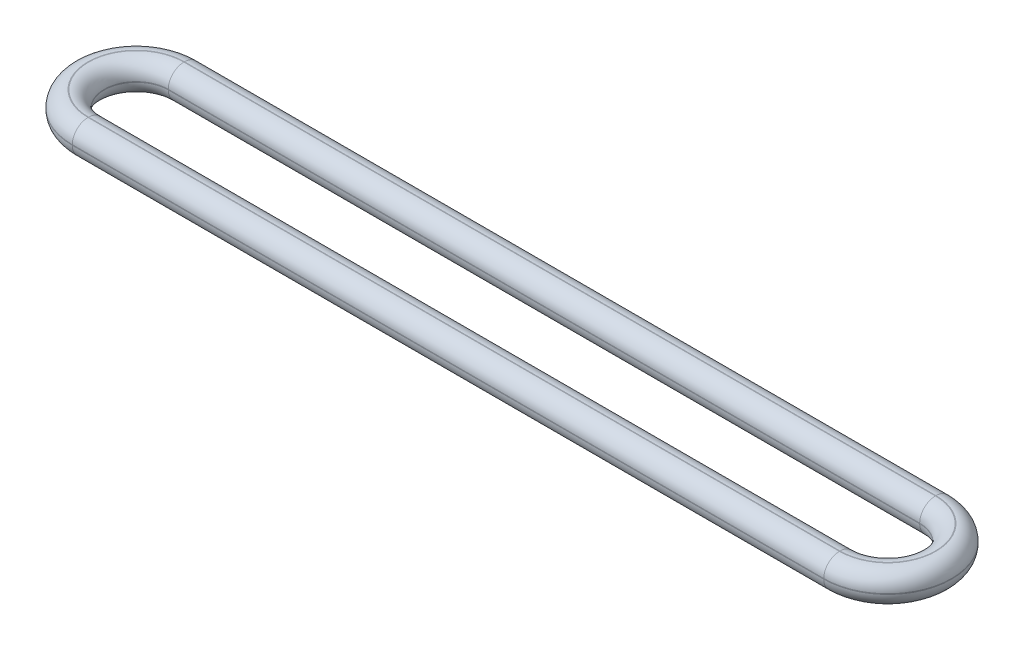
SolidWorks part; units mm, degrees
ref_plane "Front Plane" through (0, 0, 0) normal (0, 0, 1) x (1, 0, 0)
ref_plane "Top Plane" through (0, 0, 0) normal (0, 1, 0) x (1, 0, 0)
ref_plane "Right Plane" through (0, 0, 0) normal (1, 0, 0) x (0, 0, -1)
sketch "Sketch1" plane through (0, 0, 0) normal (0, 1, 0) x (1, 0, 0)
  line L0 (0, 1) -> (23.5, 1)
  line L1 (0, -0.55) -> (0, 0.55) construction
  line L2 (23.5, -1) -> (0, -1)
  line L3 (-0.55, 0) -> (0.55, 0) construction
  line L4 (0, 2) -> (23.5, 2)
  line L5 (23.5, -2) -> (0, -2)
  arc A0 (23.5, 1) -> (23.5, -1) centre (23.5, 0) cw
  arc A1 (0, 1) -> (0, -1) centre (0, 0) ccw
  arc A2 (23.5, 2) -> (23.5, -2) centre (23.5, 0) cw
  arc A3 (0, 2) -> (0, -2) centre (0, 0) ccw
  dimension "D1" = 2
  dimension "D2" = 23.5
  dimension "D3" = 1
extrude "Boss-Extrude1" add sketch "Sketch1" along normal blind 1
fillet "Fillet1" radius 0.49 16 edges at (-1, 0, 0) (11.75, 0, -1) (24.5, 0, 0) (11.75, 0, 1) (24.5, 1, 0) (11.75, 1, -1) (-1, 1, 0) (11.75, 1, 1) (11.75, 1, -2) (25.5, 1, 0) (11.75, 1, 2) (-2, 1, 0) (11.75, 0, 2) (-2, 0, 0) (11.75, 0, -2) (25.5, 0, 0)
